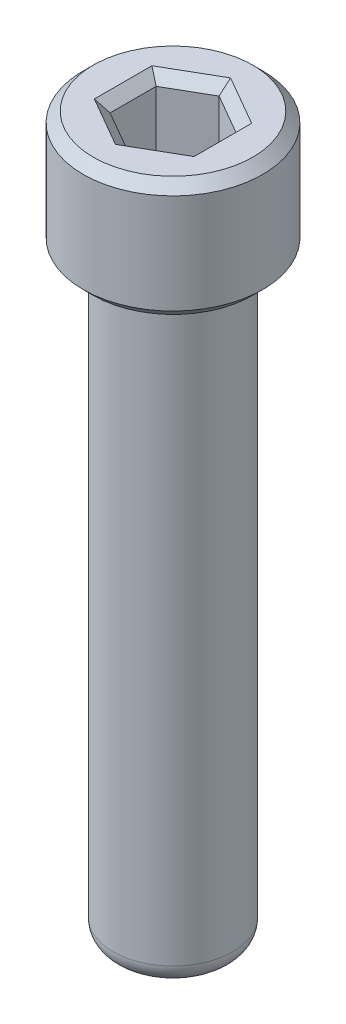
SolidWorks part; units mm, degrees
ref_plane "Front Plane" through (0, 0, 0) normal (0, 0, 1) x (1, 0, 0)
ref_plane "Top Plane" through (0, 0, 0) normal (0, 1, 0) x (1, 0, 0)
ref_plane "Right Plane" through (0, 0, 0) normal (1, 0, 0) x (0, 0, -1)
sketch "Sketch1" plane through (0, 0, 0) normal (0, 1, 0) x (1, 0, 0)
  circle A0 centre (0, 0) radius 1.5
  dimension "D1" = 3
extrude "Boss-Extrude1" add sketch "Sketch1" along normal blind 15
sketch "Sketch2" plane through (0, 15, 0) normal (0, 1, 0) x (1, 0, 0)
  circle A0 centre (0, 0) radius 2.25
  dimension "D1" = 4.5
extrude "Boss-Extrude2" add sketch "Sketch2" along normal blind 3
sketch "Sketch3" plane through (0, 18, 0) normal (0, 1, 0) x (1, 0, 0)
  line L1 (0, 1.1547) -> (-1, 0.5774)
  line L2 (-1, 0.5774) -> (-1, -0.5774)
  line L3 (-1, -0.5774) -> (0, -1.1547)
  line L4 (0, -1.1547) -> (1, -0.5774)
  line L5 (1, -0.5774) -> (1, 0.5774)
  line L6 (1, 0.5774) -> (0, 1.1547)
  circle A0 centre (0, 0) radius 1 construction
extrude "Cut-Extrude1" cut sketch "Sketch3" against normal blind 2
chamfer "Chamfer1" distance 0.25 angle 45 8 edges at (0, 15, 2.25) (0, 18, 2.25) (-0.5, 18, 0.866) (-1, 18, 0) (-0.5, 18, -0.866) (0.5, 18, -0.866) (1, 18, 0) (0.5, 18, 0.866)
fillet "Fillet1" radius 0.5 1 edges at (0, 0, 1.5)
